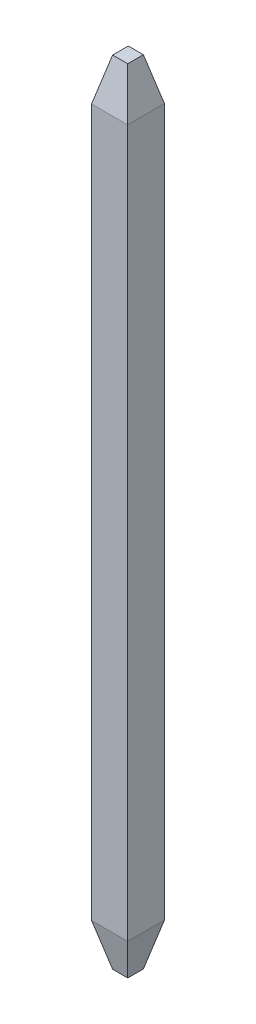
SolidWorks part; units mm, degrees
ref_plane "Front Plane" through (0, 0, 0) normal (0, 0, 1) x (1, 0, 0)
ref_plane "Top Plane" through (0, 0, 0) normal (0, 1, 0) x (1, 0, 0)
ref_plane "Right Plane" through (0, 0, 0) normal (1, 0, 0) x (0, 0, -1)
sketch "Sketch1" plane through (0, 0, 0) normal (1, 0, 0) x (0, 0, -1)
  line L1 (0, 0) -> (0.66, 0)
  line L2 (0, 0) -> (0, 14.22)
  line L3 (0, 14.22) -> (0.66, 14.22)
  line L4 (0.66, 0) -> (0.66, 14.22)
  dimension "D1" = 14.22
  dimension "D2" = 0.66
extrude "Extrude1" add sketch "Sketch1" along normal blind 0.65
chamfer "Chamfer1" distance 0.76 angle 14 8 edges at (0.325, 0, -0.66) (0, 0, -0.33) (0.325, 0, 0) (0.65, 0, -0.33) (0, 14.22, -0.33) (0.325, 14.22, -0.66) (0.325, 14.22, 0) (0.65, 14.22, -0.33)
